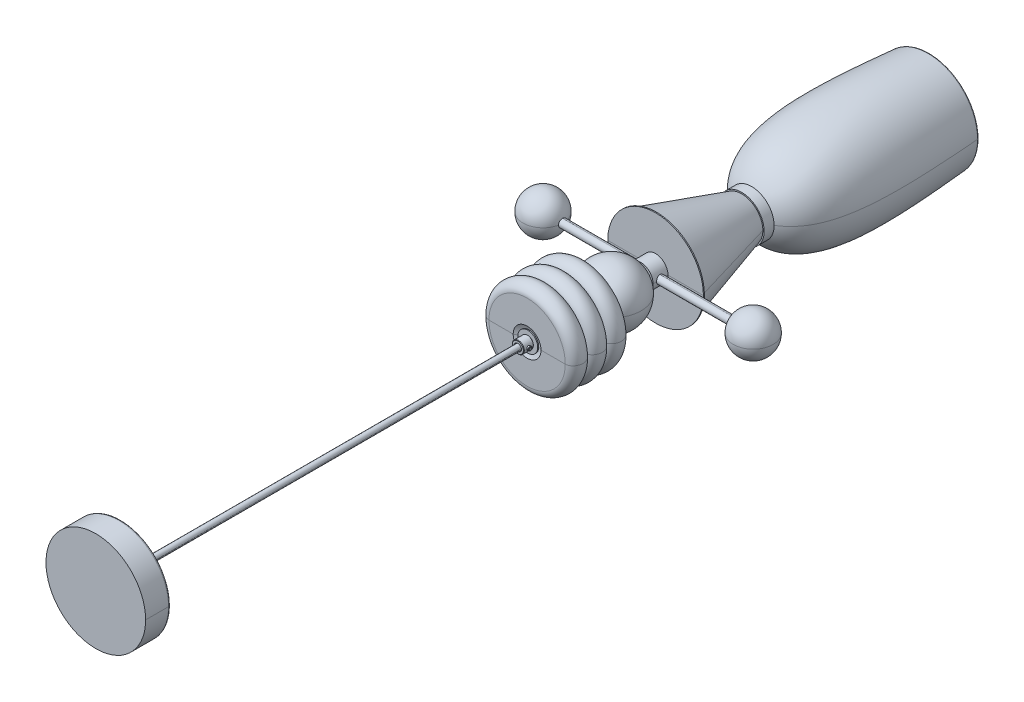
SolidWorks part; units mm, degrees
ref_plane "Alzado" through (0, 0, 0) normal (0, 0, 1) x (1, 0, 0)
ref_plane "Planta" through (0, 0, 0) normal (0, 1, 0) x (1, 0, 0)
ref_plane "Vista lateral" through (0, 0, 0) normal (1, 0, 0) x (0, 0, -1)
imported_body "NURO_C1349.STEP"
delete or keep bodies "Sólido-Eliminar/Conservar 1" type delete bodies bodies 117
delete or keep bodies "Sólido-Eliminar/Conservar 2" type delete bodies bodies 101
delete or keep bodies "Sólido-Eliminar/Conservar 3" type delete bodies bodies 102
delete or keep bodies "Sólido-Eliminar/Conservar 4" type delete bodies bodies 104
delete or keep bodies "Sólido-Eliminar/Conservar 5" type delete bodies bodies 107
delete or keep bodies "Sólido-Eliminar/Conservar 6" type delete bodies bodies 114
delete or keep bodies "Sólido-Eliminar/Conservar 7" type delete bodies bodies 113
delete or keep bodies "Sólido-Eliminar/Conservar 8" type delete bodies bodies 135
delete or keep bodies "Sólido-Eliminar/Conservar 9" type delete bodies bodies 123
delete or keep bodies "Sólido-Eliminar/Conservar 10" type delete bodies bodies 119
delete or keep bodies "Sólido-Eliminar/Conservar 11" type delete bodies bodies 130
delete or keep bodies "Sólido-Eliminar/Conservar 12" type delete bodies bodies 109
delete or keep bodies "Sólido-Eliminar/Conservar 13" type delete bodies bodies 110
delete or keep bodies "Sólido-Eliminar/Conservar 14" type delete bodies bodies 111
delete or keep bodies "Sólido-Eliminar/Conservar 15" type delete bodies bodies 115
delete or keep bodies "Sólido-Eliminar/Conservar 16" type delete bodies bodies 118
delete or keep bodies "Sólido-Eliminar/Conservar 17" type delete bodies bodies 124
delete or keep bodies "Sólido-Eliminar/Conservar 18" type delete bodies bodies 132
delete or keep bodies "Sólido-Eliminar/Conservar 19" type delete bodies bodies 133
delete or keep bodies "Sólido-Eliminar/Conservar 20" type delete bodies bodies 134
delete or keep bodies "Sólido-Eliminar/Conservar 21" type delete bodies bodies 137
delete or keep bodies "Sólido-Eliminar/Conservar 22" type delete bodies bodies 139
delete or keep bodies "Sólido-Eliminar/Conservar 23" type delete bodies bodies 129
delete or keep bodies "Sólido-Eliminar/Conservar 24" type delete bodies bodies 127
delete or keep bodies "Sólido-Eliminar/Conservar 25" type delete bodies bodies 121
delete or keep bodies "Sólido-Eliminar/Conservar 26" type delete bodies bodies 125
sketch "Croquis2" plane through (0, 0, 0) normal (0, 1, 0) x (1, 0, 0)
  line L0 (-2476.5152, -886.8231) -> (-2476.5152, -1070.126) construction
  line L1 (-2524.7322, -886.8231) -> (-2428.2982, -886.8231) construction
  line L3 (-2476.5152, -1070.126) -> (-2453.9024, -1070.126) construction
  line L4 (-2453.9024, -1075.126) -> (-2453.9024, -1065.126)
  line L5 (-2453.9024, -1065.126) -> (-2476.5152, -1065.126)
  line L6 (-2453.9024, -1075.126) -> (-2476.5152, -1075.126)
  line L7 (-2476.5152, -1075.126) -> (-2476.5152, -1065.126)
  point P10 (-2453.9024, -1070.126)
  dimension "D1" = 10
revolve "Revolución1" add sketch "Croquis2" angle 360 about L7
